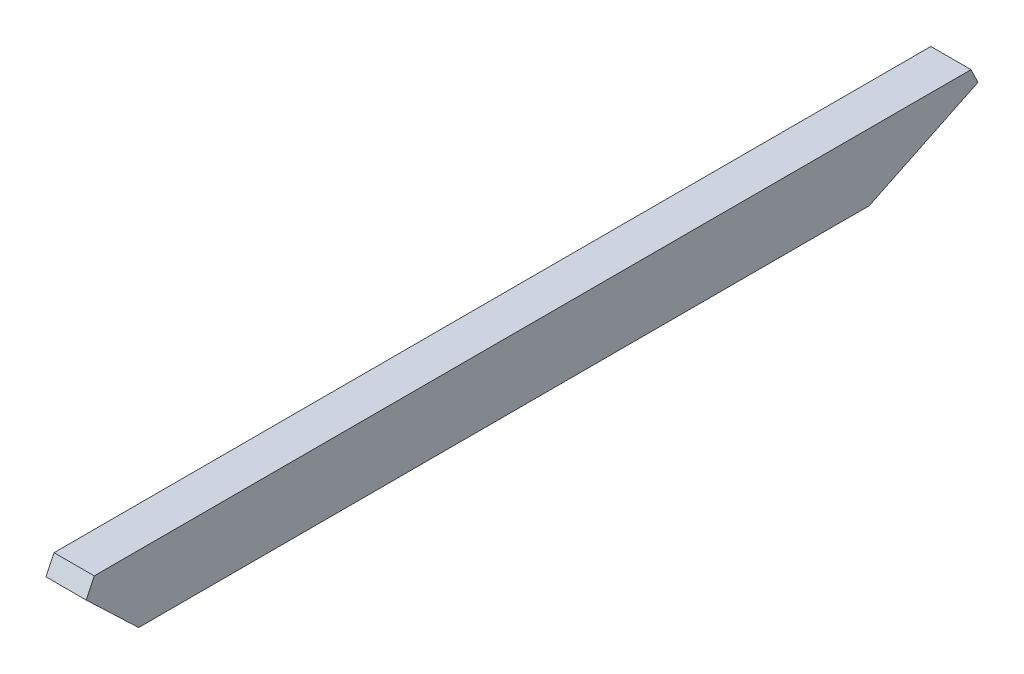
SolidWorks part; units mm, degrees
ref_plane "Face" through (0, 0, 0) normal (0, 0, 1) x (1, 0, 0)
ref_plane "Dessus" through (0, 0, 0) normal (0, 1, 0) x (1, 0, 0)
ref_plane "Droite" through (0, 0, 0) normal (1, 0, 0) x (0, 0, -1)
sketch "Esquisse1" plane through (0, 0, 0) normal (0, 0, 1) x (1, 0, 0)
  line L1 (0, 0) -> (15, 0)
  line L2 (0, 0) -> (0, 25)
  line L3 (0, 25) -> (15, 25)
  line L4 (15, 0) -> (15, 25)
  dimension "D1" = 15
  dimension "D2" = 25
extrude "Extrusion1" add sketch "Esquisse1" along normal blind 333
sketch "Esquisse2" plane through (0, 0, 0) normal (-1, 0, 0) x (0, 0, 1)
  line L0 (2.6076, 25) -> (0, 19.5963)
  line L1 (333, 25) -> (0, 25) construction
  line L2 (0, 25) -> (0, 0) construction
  line L3 (2.6076, 25) -> (-2.4708, 25)
  line L4 (-2.4708, 25) -> (0, 19.5963)
  dimension "D1" = 115.76
  dimension "D2" = 6
extrude "Enlèv. mat.-Extru.1" cut sketch "Esquisse2" against normal through all
sketch "Esquisse3" plane through (0, 0, 0) normal (-1, 0, 0) x (0, 0, 1)
  line L0 (0, 19.5963) -> (40.6091, 0)
  line L1 (333, 25) -> (2.6076, 25) construction
  line L2 (333, 0) -> (0, 0) construction
  line L3 (40.6091, 0) -> (40.6091, -4.503)
  line L4 (40.6091, -4.503) -> (-8.4461, -4.503)
  line L5 (-8.4461, -4.503) -> (0, 19.5963)
  dimension "D1" = 154.24
extrude "Enlèv. mat.-Extru.2" cut sketch "Esquisse3" against normal through all
sketch "Esquisse4" plane through (0, 0, 0) normal (-1, 0, 0) x (0, 0, 1)
  line L1 (333, 25) -> (2.6076, 25) construction
  line L2 (329.9076, 25) -> (332.9076, 18.6754)
  line L3 (313.3245, 0) -> (366.2595, 0)
  line L4 (366.2595, 0) -> (363.5689, 25)
  line L5 (363.5689, 25) -> (329.9076, 25)
  line L6 (332.9076, 18.6754) -> (313.3245, 0)
  line L7 (333, 0) -> (40.6091, 0) construction
  dimension "D1" = 7
  dimension "D2" = 327.3
  dimension "D3" = 30
  dimension "D4" = 3
extrude "Enlèv. mat.-Extru.3" cut sketch "Esquisse4" against normal through all
